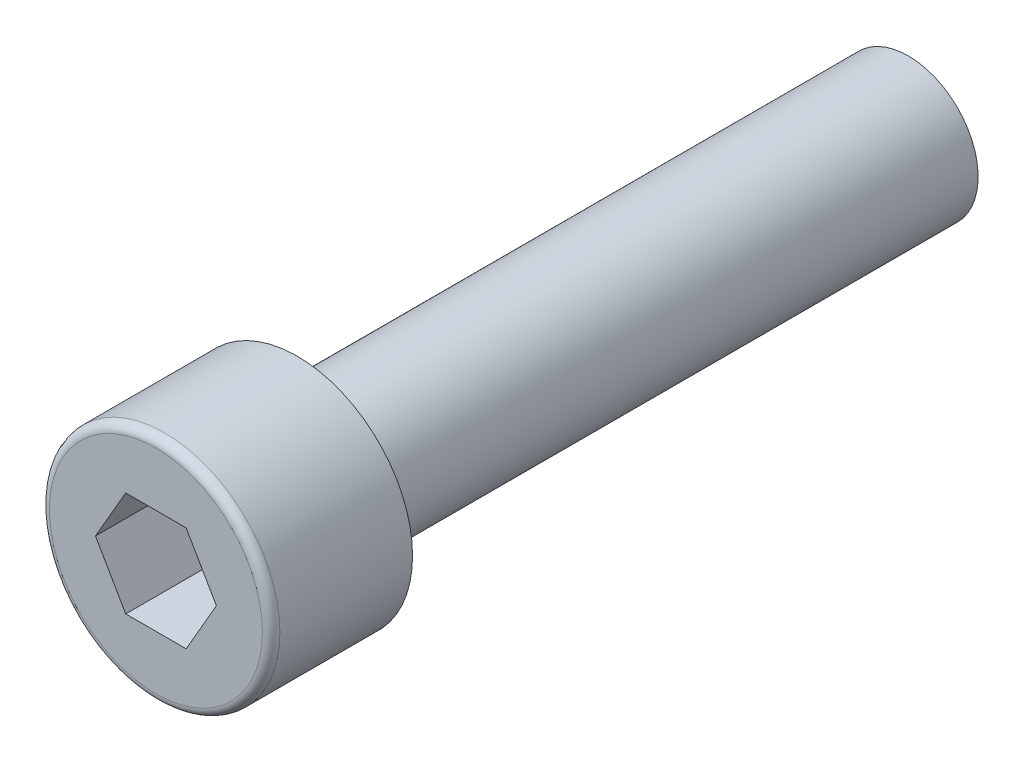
SolidWorks part; units mm, degrees
ref_plane "正面" through (0, 0, 0) normal (0, 0, 1) x (1, 0, 0)
ref_plane "平面" through (0, 0, 0) normal (0, 1, 0) x (1, 0, 0)
ref_plane "右側面" through (0, 0, 0) normal (1, 0, 0) x (0, 0, -1)
sketch "ｽｹｯﾁ1" plane through (0, 0, 0) normal (0, 0, 1) x (1, 0, 0)
  circle A0 centre (0, 0) radius 6.6
  dimension "D1" = 13.2
extrude "ﾎﾞｽ - 押し出し1" add sketch "ｽｹｯﾁ1" against normal blind 8.1
sketch "ｽｹｯﾁ2" plane through (0, 0, -8.1) normal (0, 0, -1) x (-1, 0, 0)
  circle A0 centre (0, 0) radius 4
  dimension "D1" = 8
extrude "ﾎﾞｽ - 押し出し2" add sketch "ｽｹｯﾁ2" along normal blind 35
sketch "ｽｹｯﾁ3" plane through (0, 0, 0) normal (0, 0, 1) x (1, 0, 0)
  line L1 (3.4641, 0) -> (1.7321, 3)
  line L2 (1.7321, 3) -> (-1.7321, 3)
  line L3 (-1.7321, 3) -> (-3.4641, 0)
  line L4 (-3.4641, 0) -> (-1.7321, -3)
  line L5 (-1.7321, -3) -> (1.7321, -3)
  line L6 (1.7321, -3) -> (3.4641, 0)
  circle A0 centre (0, 0) radius 3 construction
  dimension "D1" = 6
extrude "ｶｯﾄ - 押し出し1" cut sketch "ｽｹｯﾁ3" against normal blind 4.5
fillet "ﾌｨﾚｯﾄ1" radius 0.5 1 edges at (6.6, 0, 0)
